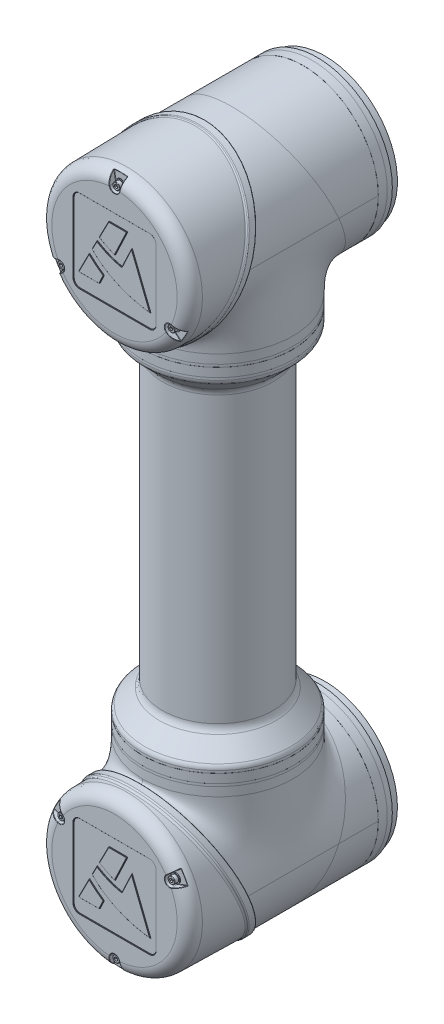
SolidWorks part; units mm, degrees
ref_plane "前视基准面" through (0, 0, 0) normal (0, 0, 1) x (1, 0, 0)
ref_plane "上视基准面" through (0, 0, 0) normal (0, 1, 0) x (1, 0, 0)
ref_plane "右视基准面" through (0, 0, 0) normal (1, 0, 0) x (0, 0, -1)
imported_body "SIZE3简化模型(反LOGO)-1-solid1"
imported_body "SIZE3简化模型(反LOGO)-1-solid2"
imported_body "SIZE3简化模型(反LOGO)-1-solid3"
imported_body "SIZE3简化模型(反LOGO)-1-solid4"
imported_body "GBT-C5A-200.01-0200_defeature-1-solid1"
imported_body "SIZE3简化模型-1-solid1"
imported_body "SIZE3简化模型-1-solid2"
imported_body "SIZE3简化模型-1-solid3"
imported_body "SIZE3简化模型-1-solid4"
sketch "草图1" plane through (0, 0, 0) normal (0, 0, 1) x (1, 0, 0)
  line L0 (0, 0) -> (0, 523.8448) construction
  line L1 (-57, 78) -> (57, 78) construction
  line L2 (57, 78) -> (59, 78)
  line L3 (57, 78) -> (57, 71)
  line L4 (57, 71) -> (59, 71)
  line L5 (59, 78) -> (59, 71)
  line L6 (-59, 78) -> (59, 78) construction
  line L7 (59, 71) -> (-59, 71) construction
  line L8 (-57, 354) -> (57, 354) construction
  line L9 (57, 354) -> (59, 354)
  line L10 (57, 354) -> (57, 347)
  line L11 (57, 347) -> (59, 347)
  line L12 (59, 354) -> (59, 347)
  line L13 (-59, 354) -> (59, 354) construction
  line L14 (59, 347) -> (-59, 347) construction
  line L15 (57, 347) -> (-57, 347) construction
  dimension "D1" = 114
  dimension "D2" = 2
  dimension "D3" = 114
  dimension "D4" = 2
revolve "旋转1" add sketch "草图1" angle 360 about L0
